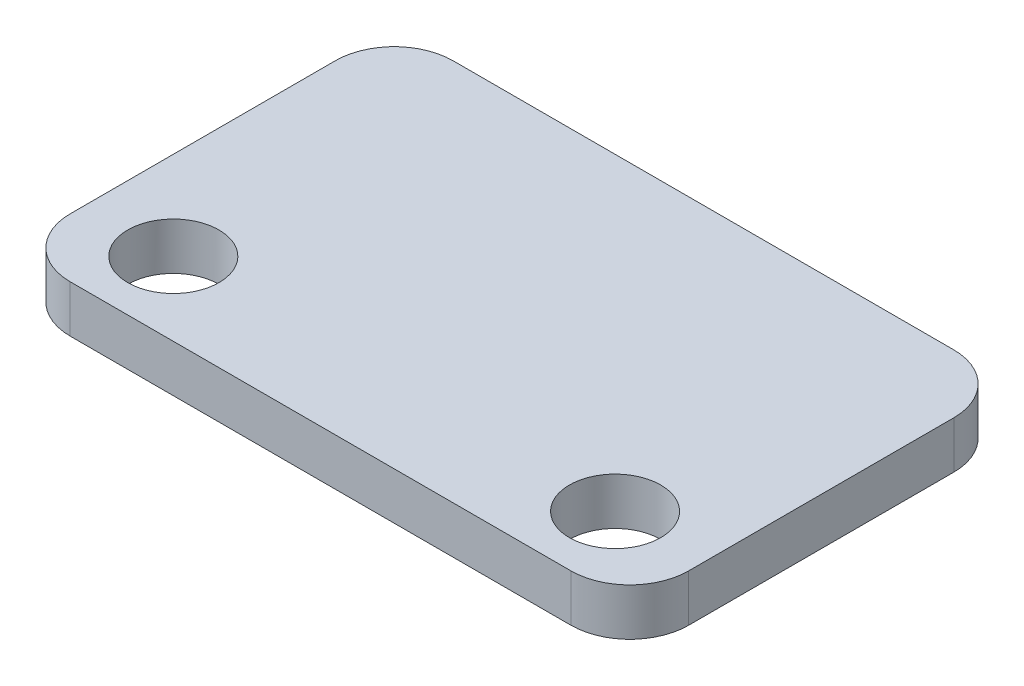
SolidWorks part; units mm, degrees
ref_plane "前视基准面" through (0, 0, 0) normal (0, 0, 1) x (1, 0, 0)
ref_plane "上视基准面" through (0, 0, 0) normal (0, 1, 0) x (1, 0, 0)
ref_plane "右视基准面" through (0, 0, 0) normal (1, 0, 0) x (0, 0, -1)
other "Configuration Table"
sketch "草图1" plane through (0, 0, 0) normal (0, 1, 0) x (1, 0, 0)
  line L1 (-8.5, 6.5) -> (8.5, 6.5)
  line L2 (-10.5, 4.5) -> (-10.5, -4.5)
  line L3 (-8.5, -6.5) -> (8.5, -6.5)
  line L4 (10.5, 4.5) -> (10.5, -4.5)
  line L5 (-10.5, 6.5) -> (10.5, -6.5) construction
  line L6 (-10.5, -6.5) -> (10.5, 6.5) construction
  arc A0 (8.5, 6.5) -> (10.5, 4.5) centre (8.5, 4.5) cw
  arc A1 (8.5, -6.5) -> (10.5, -4.5) centre (8.5, -4.5) ccw
  arc A2 (-10.5, -4.5) -> (-8.5, -6.5) centre (-8.5, -4.5) ccw
  arc A3 (-8.5, 6.5) -> (-10.5, 4.5) centre (-8.5, 4.5) ccw
  point P0 (0, 0)
  dimension "D3" = 2
  dimension "D1" = 21
  dimension "D2" = 13
extrude "凸台-拉伸1" add sketch "草图1" along normal blind 1.6
sketch "草图2" plane through (0, 1.6, 0) normal (0, 1, 0) x (1, 0, 0)
  line L0 (0, 0) -> (0, -8.7549) construction
  line L1 (-8.5, -6.5) -> (8.5, -6.5) construction
  circle A0 centre (-7.5, -4) radius 1.55
  circle A1 centre (7.5, -4) radius 1.55
  dimension "D1" = 15
  dimension "D2" = 3.1
  dimension "D3" = 2.5
extrude "切除-拉伸1" cut sketch "草图2" against normal up to next
